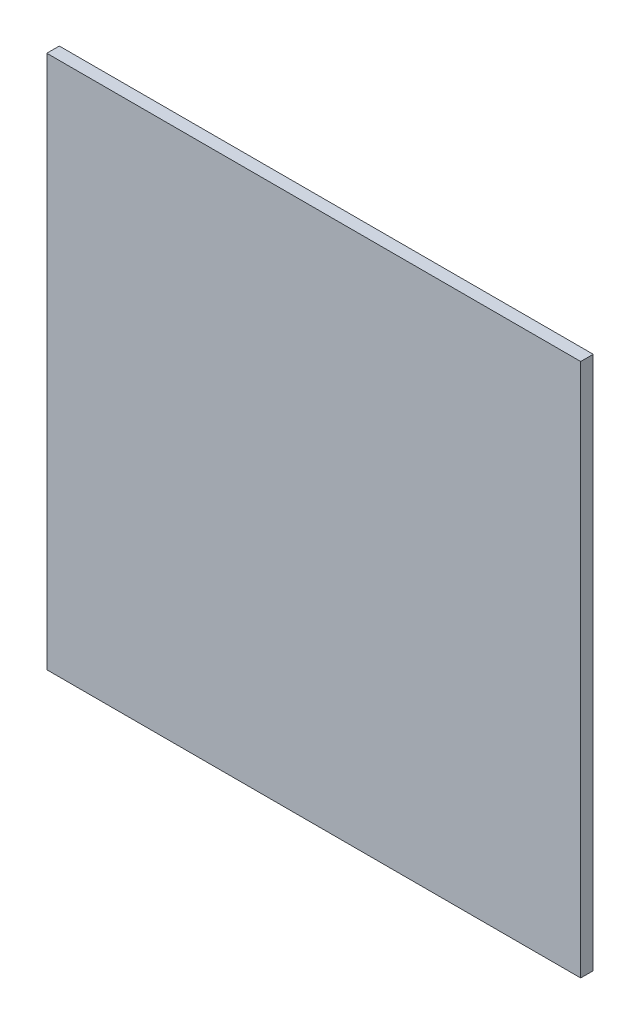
SolidWorks part; units mm, degrees
ref_plane "Front" through (0, 0, 0) normal (0, 0, 1) x (1, 0, 0)
ref_plane "Top" through (0, 0, 0) normal (0, 1, 0) x (1, 0, 0)
ref_plane "Right" through (0, 0, 0) normal (1, 0, 0) x (0, 0, -1)
sketch "Sketch1" plane through (0, 0, 0) normal (0, 0, 1) x (1, 0, 0)
  line L1 (0, 0) -> (406.4, 0)
  line L2 (0, 0) -> (0, 406.4)
  line L3 (0, 406.4) -> (406.4, 406.4)
  line L4 (406.4, 0) -> (406.4, 406.4)
  dimension "D1" = 406.4
extrude "Extrude1" add sketch "Sketch1" along normal blind 9.525
